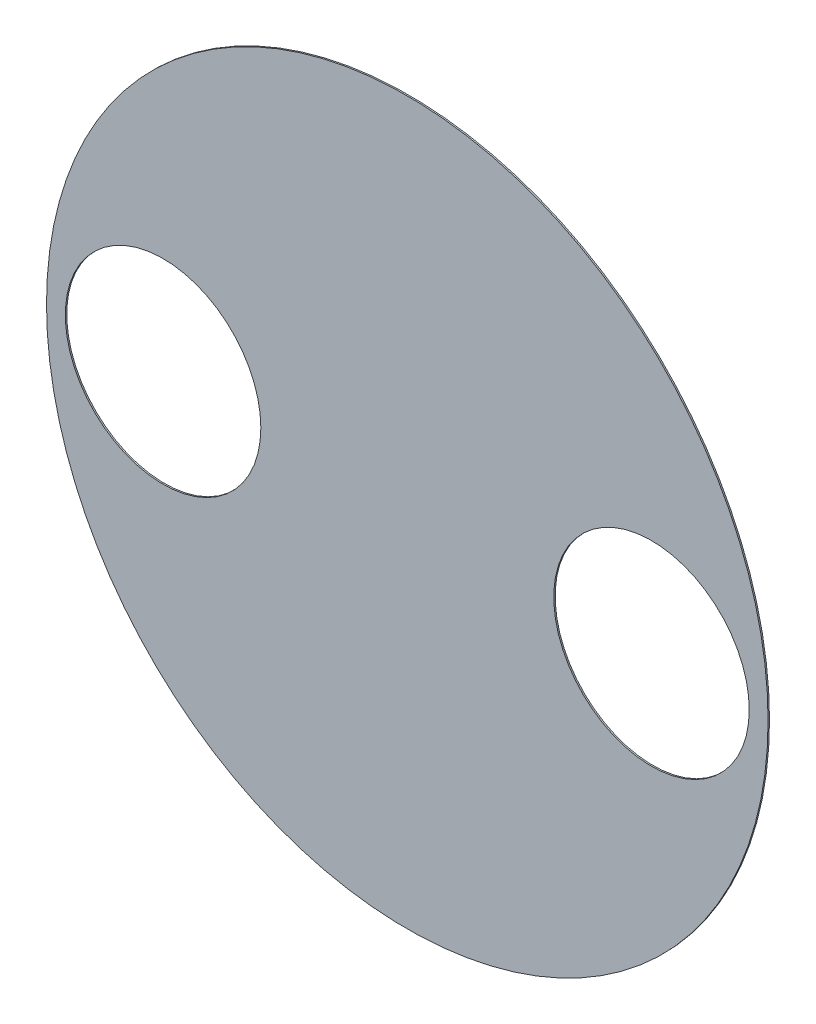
SolidWorks part; units mm, degrees
ref_plane "Front Plane" through (0, 0, 0) normal (0, 0, 1) x (1, 0, 0)
ref_plane "Top Plane" through (0, 0, 0) normal (0, 1, 0) x (1, 0, 0)
ref_plane "Right Plane" through (0, 0, 0) normal (1, 0, 0) x (0, 0, -1)
sketch "Sketch1" plane through (0, 0, 0) normal (0, 0, 1) x (1, 0, 0)
  circle A0 centre (0, 0) radius 507.5
  dimension "total dia" = 1015
base flange "Base-Flange1" sketch "Sketch1" thickness 2 reverse thickness direction no parameters "D1"=1
sketch "Sketch6" plane through (0, 0, 0) normal (0, 0, 1) x (1, 0, 0)
  line L0 (-343.5, 0) -> (343.5, 0) construction
  circle A0 centre (343.5, 0) radius 137.5
  circle A1 centre (-343.5, 0) radius 137.5
  dimension "Hole 2" = 275
  dimension "Hole 1" = 275
  dimension "Gap btwn 2 holes" = 687
extrude "Cut-Extrude2" cut sketch "Sketch6" against normal blind 10 contours A1 | A0
sketch "Bend-Lines1" [suppressed] plane through (0, 0, 0) normal (0, 1, 0) x (1, 0, 0)
sketch "Bounding-Box1" [suppressed] plane through (0, 0, 0) normal (0, 1, 0) x (1, 0, 0)
sheet metal parameters "Sheet-Metal1" thickness 2 parameters "D1"=1
flat pattern "Flat-Pattern1"
sketch "Bend-Lines2" plane through (0, 0, 0) normal (0, 1, 0) x (1, 0, 0)
sketch3d "Bounding-Box2" [suppressed]
  line L0 (507.3263, 507.6734, 0) -> (507.6735, -507.3261, 0) construction
  line L1 (-507.673, 507.3261, 0) -> (-507.3258, -507.6734, 0) construction
  line L2 (507.3263, 507.6734, 0) -> (-507.673, 507.3261, 0) construction
  line L3 (507.6735, -507.3261, 0) -> (-507.3258, -507.6734, 0) construction
sheet metal parameters "Sheet-Metal3" thickness 2 parameters "D1"=1
flat pattern "Flat-Pattern1"
sketch "Bend-Lines2" plane through (0, 0, 0) normal (0, 1, 0) x (1, 0, 0)
sketch3d "Bounding-Box2" [suppressed]
  line L0 (507.3263, 507.6734, 0) -> (507.6735, -507.3261, 0) construction
  line L1 (-507.673, 507.3261, 0) -> (-507.3258, -507.6734, 0) construction
  line L2 (507.3263, 507.6734, 0) -> (-507.673, 507.3261, 0) construction
  line L3 (507.6735, -507.3261, 0) -> (-507.3258, -507.6734, 0) construction
equation "\"Total Dia 1\"= 1015"
equation "\"Total Dia 1.1\"= 1025"
equation "\"Gap btw 2 Holes 1\"= 687"
equation "\"Gap btw 2 Holes 1.\"= 697"
equation "\"Hole1 1\"= 275"
equation "\"Hole1 1.1\"= 285"
equation "\"Hole2 1\"= 275"
equation "\"Hole2 1.1\"= 285"
